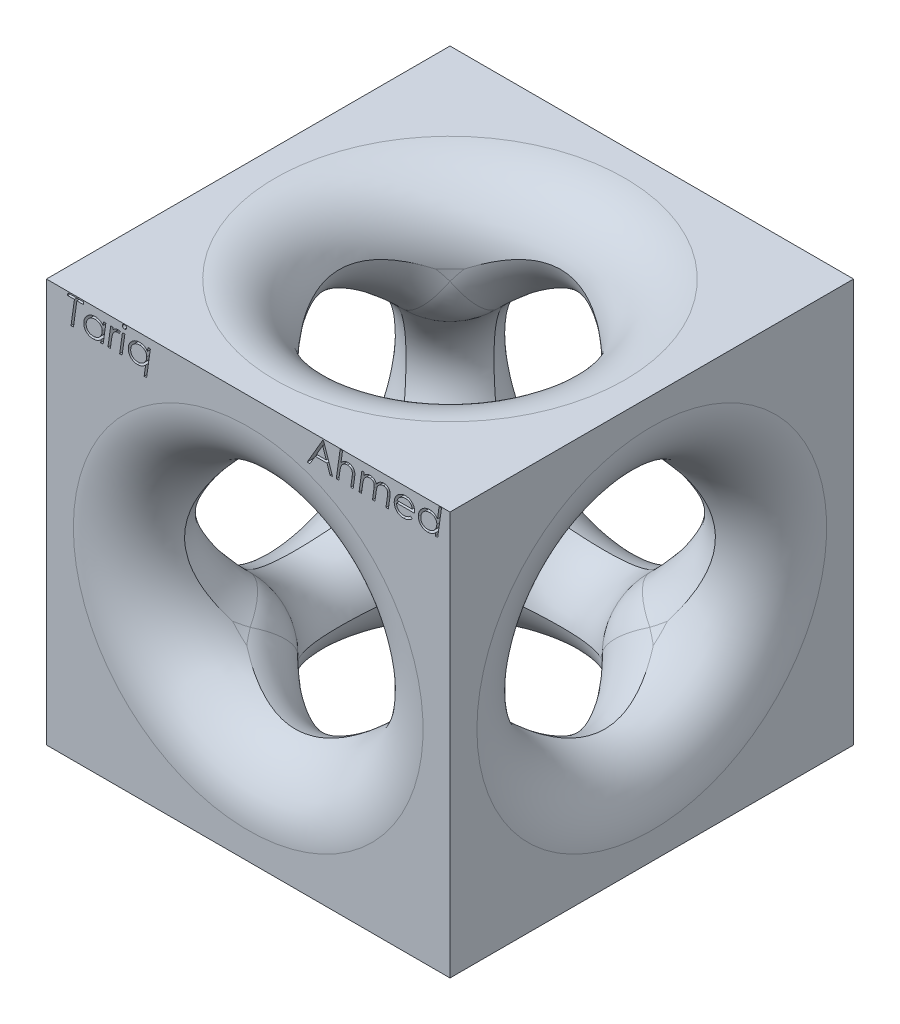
SolidWorks part; units mm, degrees
ref_plane "Front Plane" through (0, 0, 0) normal (0, 0, 1) x (1, 0, 0)
ref_plane "Top Plane" through (0, 0, 0) normal (0, 1, 0) x (1, 0, 0)
ref_plane "Right Plane" through (0, 0, 0) normal (1, 0, 0) x (0, 0, -1)
sketch "Sketch1" plane through (0, 0, 0) normal (0, 0, 1) x (1, 0, 0)
  line L1 (0, 0) -> (-30, 0)
  line L2 (0, 0) -> (0, 30)
  line L3 (0, 30) -> (-30, 30)
  line L4 (-30, 0) -> (-30, 30)
  dimension "D1" = 30
  dimension "D2" = 30
extrude "Boss-Extrude1" add sketch "Sketch1" along normal blind 30 contours L4 L3 L2 L1
sketch "Sketch2" plane through (0, 0, 0) normal (0, 0, 1) x (1, 0, 0)
  circle A0 centre (-15, 15) radius 8
extrude "Cut-Extrude2" cut sketch "Sketch2" along normal blind 30 contours A0
sketch "Sketch3" plane through (0, 0, 0) normal (0, 1, 0) x (1, 0, 0)
  circle A0 centre (-15, -15) radius 8
extrude "Cut-Extrude3" cut sketch "Sketch3" along normal blind 30 contours A0
sketch "Sketch4" plane through (0, 0, 0) normal (1, 0, 0) x (0, 0, -1)
  circle A0 centre (-15, 15) radius 8
extrude "Cut-Extrude4" cut sketch "Sketch4" against normal blind 30 contours A0
fillet "Fillet2" radius 5 18 edges at (-7, 15, 0) (-7, 15, 30) (-15, 0, 23) (-15, 30, 23) (-15, 23, 23) (-15, 23, 7) (-23, 23, 15) (-7, 23, 15) (-15, 7, 7) (-15, 7, 23) (-23, 15, 23) (-23, 7, 15) (-23, 15, 7) (-7, 15, 7) (-7, 7, 15) (-7, 15, 23) (-30, 15, 7) (0, 15, 7)
sketch "Sketch6" plane through (0, 0, 30) normal (0, 0, 1) x (1, 0, 0)
  text T0 "<i>Tariq               Ahmed</i>" font "Century Gothic" height 2
extrude "Cut-Extrude5" cut sketch "Sketch6" against normal blind 2
